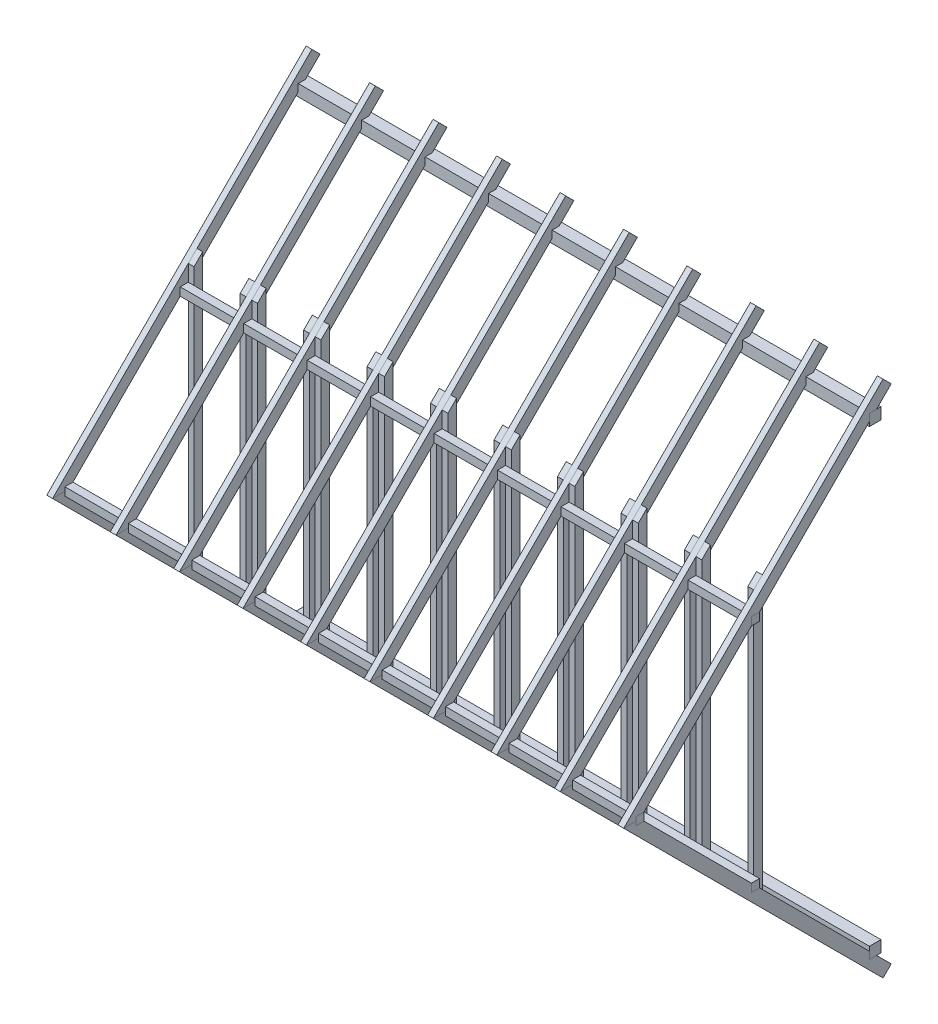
SolidWorks part; units mm, degrees
ref_plane "Płaszczyzna przednia" through (0, 0, 0) normal (0, 0, 1) x (1, 0, 0)
ref_plane "Płaszczyzna górna" through (0, 0, 0) normal (0, 1, 0) x (1, 0, 0)
ref_plane "Płaszczyzna prawa" through (0, 0, 0) normal (1, 0, 0) x (0, 0, -1)
sketch "Szkic1" plane through (0, 0, 0) normal (0, 0, 1) x (1, 0, 0)
  line L1 (5000, -4000) -> (-5000, -4000)
  line L2 (5000, -4000) -> (5000, 4000)
  line L3 (5000, 4000) -> (-5000, 4000)
  line L4 (-5000, -4000) -> (-5000, 4000)
  line L5 (5000, -4000) -> (-5000, 4000) construction
  line L6 (5000, 4000) -> (-5000, -4000) construction
  point P0 (0, 0)
  dimension "D1" = 10000
  dimension "D2" = 8000
ref_plane "Płaszczyzna1" through (-5000, 0, 0) normal (1, 0, 0) x (0, 0, -1)
sketch "Szkic2" plane through (-5000, 0, 0) normal (1, 0, 0) x (0, 0, -1)
  line L0 (353.5534, 4353.5534) -> (-4000, 0)
  line L1 (-4000, 0) -> (353.5534, -4353.5534)
  line L2 (0, -4000) -> (0, 4000) construction
  point P7 (1360.1223, -4867.8631)
  point P8 (0, 0)
  dimension "D1" = 500
  dimension "D2" = 45
ref_plane "Płaszczyzna2" through (0, 0, 2000) normal (0, 0, 1) x (1, 0, 0)
sketch "Szkic3" plane through (0, 0, 2000) normal (0, 0, 1) x (1, 0, 0)
  line L0 (-5000, -2000) -> (5000, -2000)
  line L3 (5000, -4000) -> (-5000, -4000) construction
  point P2 (0, 0)
sketch "Szkic4" plane through (0, 0, 0) normal (0, 1, 0) x (1, 0, 0)
  line L0 (-5000, -4000) -> (5000, -4000)
  line L1 (-5000, -2000) -> (5000, -2000) construction
other "Więźba dachowa MURŁATA 200 X 200(1)"
ref_plane "Płaszczyzna3" through (5000, 4000, -75) normal (-1, 0, 0) x (0, -1, 0)
sketch "Szkic11" plane through (5000, 4000, -75) normal (-1, 0, 0) x (0, -1, 0)
  line L0 (0, 75) -> (0, -75) construction
  line L1 (100, -100) -> (-100, -100)
  line L2 (100, -100) -> (100, 100)
  line L3 (100, 100) -> (-100, 100)
  line L4 (-100, -100) -> (-100, 100)
  line L5 (100, -100) -> (-100, 100) construction
  line L6 (100, 100) -> (-100, -100) construction
  point P0 (0, 0)
  point P8 (0, 0)
  dimension "D1" = 200
  dimension "D2" = 200
  dimension "D3" = 75
other "Więźba dachowa PŁATEW 140X140(1)"
ref_plane "Płaszczyzna5" through (-5000, -2000, 2000) normal (1, 0, 0) x (0, 1, 0)
sketch "Szkic13" plane through (-5000, -2000, 2000) normal (1, 0, 0) x (0, 1, 0)
  line L0 (0, 50) -> (0, -50) construction
  line L1 (70, -70) -> (-70, -70)
  line L2 (70, -70) -> (70, 70)
  line L3 (70, 70) -> (-70, 70)
  line L4 (-70, -70) -> (-70, 70)
  line L5 (70, -70) -> (-70, 70) construction
  line L6 (70, 70) -> (-70, -70) construction
  point P0 (0, 0)
  point P8 (0, 0)
  dimension "D1" = 140
  dimension "D2" = 140
  dimension "D3" = 50
other "Więźba dachowa KROKIEW 200 X 100(1)"
ref_plane "Płaszczyzna6" through (-4950, -70.7107, 4070.7107) normal (0, -0.7071, -0.7071) x (1, 0, 0)
sketch "Szkic14" plane through (-4950, -70.7107, 4070.7107) normal (0, -0.7071, -0.7071) x (1, 0, 0)
  line L0 (0, 50) -> (0, -50) construction
  line L1 (50, -100) -> (-50, -100)
  line L2 (50, -100) -> (50, 100)
  line L3 (50, 100) -> (-50, 100)
  line L4 (-50, -100) -> (-50, 100)
  line L5 (50, -100) -> (-50, 100) construction
  line L6 (50, 100) -> (-50, -100) construction
  point P0 (0, 0)
  point P8 (0, 0)
  dimension "D1" = 200
  dimension "D2" = 100
  dimension "D3" = 50
other "Przytnij/Wydłuż1"
other "Przytnij/Wydłuż2"
pattern_linear "Szyk liniowy1" count 10 spacing 1100 along (1, 0, 0)
mirror "Lustro1" about plane through (0, 0, 0) normal (0, 1, 0)
sketch "Szkic15" plane through (0, 0, 1930) normal (0, 0, -1) x (-1, 0, 0)
  line L0 (-4900, -2352.8427) -> (-4900, 2352.8427)
  point P2 (0, 0)
  point P6 (0, 0)
  point P7 (0, 0)
  point P8 (0, 0)
other "Więźba dachowa BELKA WIĄZARA 150X100(1)"
ref_plane "Płaszczyzna7" through (4900, -2352.8427, 1930) normal (0, 1, 0) x (1, 0, 0)
sketch "Szkic16" plane through (4900, -2352.8427, 1930) normal (0, 1, 0) x (1, 0, 0)
  line L0 (0, 50) -> (0, -50) construction
  line L1 (50, -75) -> (-50, -75)
  line L2 (50, -75) -> (50, 75)
  line L3 (50, 75) -> (-50, 75)
  line L4 (-50, -75) -> (-50, 75)
  line L5 (50, -75) -> (-50, 75) construction
  line L6 (50, 75) -> (-50, -75) construction
  point P0 (0, 0)
  point P8 (0, 0)
  dimension "D1" = 150
  dimension "D2" = 100
  dimension "D3" = 50
other "Przytnij/Wydłuż3"
pattern_linear "Szyk liniowy2" count 9 spacing 1100 along (-1, 0, 0)
mirror "Lustro2" about plane through (0, 0, 0) normal (1, 0, 0)
